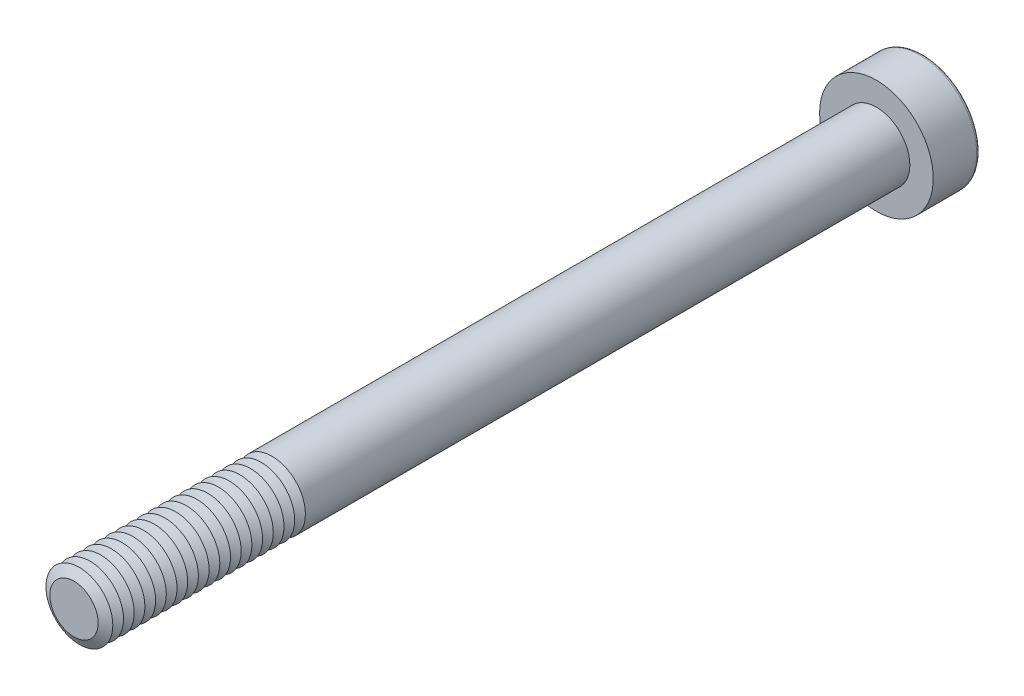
SolidWorks part; units mm, degrees
ref_plane "Front Plane" through (0, 0, 0) normal (0, 0, 1) x (1, 0, 0)
ref_plane "Top Plane" through (0, 0, 0) normal (0, 1, 0) x (1, 0, 0)
ref_plane "Right Plane" through (0, 0, 0) normal (1, 0, 0) x (0, 0, -1)
sketch "Sketch1" plane through (0, 0, 0) normal (0, 0, 1) x (1, 0, 0)
  circle A0 centre (0, 0) radius 2.5
  dimension "D1" = 5
extrude "Boss-Extrude1" add sketch "Sketch1" along normal blind 60
sketch "Sketch2" plane through (0, 0, 0) normal (0, 0, -1) x (-1, 0, 0)
  circle A0 centre (0, 0) radius 4.25
  dimension "D1" = 8.5
extrude "Boss-Extrude2" add sketch "Sketch2" along normal blind 3.5
sketch "Sketch3" plane through (0, 0, -3.5) normal (0, 0, -1) x (-1, 0, 0)
  line L1 (-0.866, 1.5) -> (-1.7321, 0)
  line L2 (-1.7321, 0) -> (-0.866, -1.5)
  line L3 (-0.866, -1.5) -> (0.866, -1.5)
  line L4 (0.866, -1.5) -> (1.7321, 0)
  line L5 (1.7321, 0) -> (0.866, 1.5)
  line L6 (0.866, 1.5) -> (-0.866, 1.5)
  circle A0 centre (0, 0) radius 1.5 construction
  dimension "D1" = 3
extrude "Cut-Extrude1" cut sketch "Sketch3" against normal blind 2.25
fillet "Fillet1" radius 0.25 1 edges at (-4.25, 0, -3.5)
sketch "Sketch4" plane through (0, 0, -1.25) normal (0, 0, -1) x (-1, 0, 0)
  line L0 (0.866, -1.5) -> (1.7321, 0) construction
  circle A0 centre (0, 0) radius 1.5
extrude "Cut-Extrude2" cut sketch "Sketch4" against normal through all draft 60
sketch "Sketch5" plane through (0, 0, -3.5) normal (0, 0, -1) x (-1, 0, 0)
  circle A0 centre (0, 0) radius 1.7321
extrude "Cut-Extrude3" cut sketch "Sketch5" against normal through all draft 75
sketch "Sketch7" plane through (0, 0, 0) normal (1, 0, 0) x (0, 0, -1)
  line L25 (-60, 1.8072) -> (-59.6, 2.5)
  line L26 (-60, 2.5) -> (-60, -2.5) construction
  line L27 (-59.6, 2.5) -> (-60.4, 2.5)
  line L28 (-60.4, 2.5) -> (-60, 1.8072)
  line L29 (0, 2.5) -> (-60, 2.5) construction
  dimension "D1" = 0.8
revolve "Cut-Revolve1" cut sketch "Sketch7" angle 360 about axis through (0, 0, 60) along (0, 0, -1)
pattern_linear "LPattern1" count 19 spacing 0.8 along (0, 0, -1) of "Cut-Revolve1"
